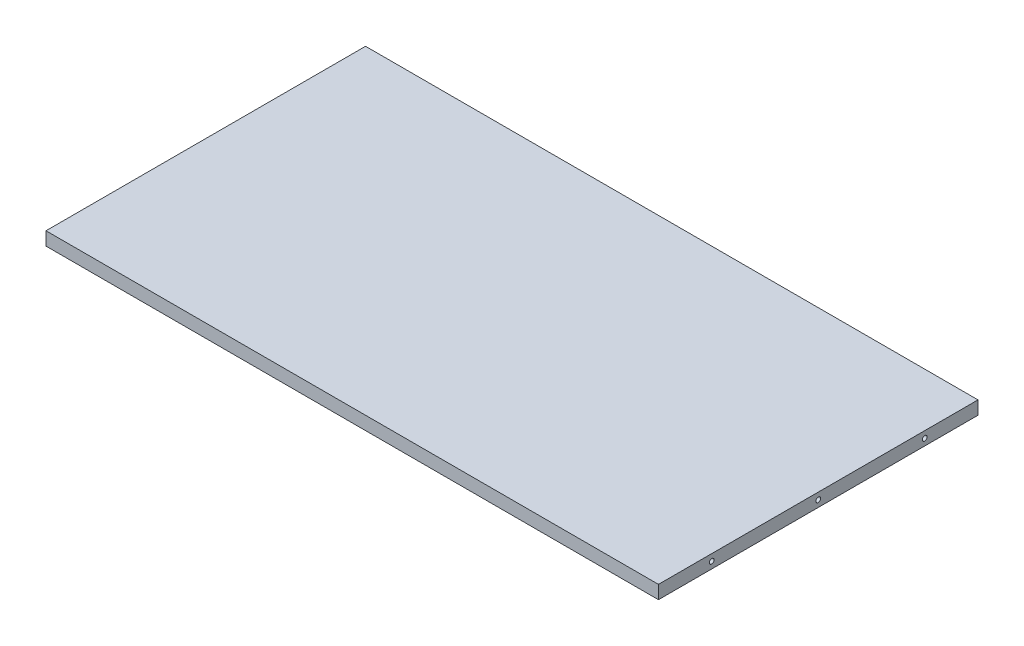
SolidWorks part; units mm, degrees
ref_plane "Front Plane" through (0, 0, 0) normal (0, 0, 1) x (1, 0, 0)
ref_plane "Top Plane" through (0, 0, 0) normal (0, 1, 0) x (1, 0, 0)
ref_plane "Right Plane" through (0, 0, 0) normal (1, 0, 0) x (0, 0, -1)
sketch "Sketch1" plane through (0, 0, 0) normal (0, 1, 0) x (1, 0, 0)
  line L1 (-146.05, -76.2) -> (146.05, -76.2)
  line L2 (-146.05, -76.2) -> (-146.05, 76.2)
  line L3 (-146.05, 76.2) -> (146.05, 76.2)
  line L4 (146.05, -76.2) -> (146.05, 76.2)
  line L5 (-146.05, -76.2) -> (146.05, 76.2) construction
  line L6 (-146.05, 76.2) -> (146.05, -76.2) construction
  point P0 (0, 0)
extrude "Boss-Extrude1" add sketch "Sketch1" along normal blind 6.35
hole_wizard "#4-40 Tapped Hole1" positions "Sketch2" profile "Sketch4" tap size "#4-40" standard "ANSI Inch"
sketch "Sketch2" plane through (146.05, 0, 0) normal (1, 0, 0) x (0, 0, -1)
  line L0 (76.2, 6.35) -> (76.2, 0) construction
  line L1 (-76.2, 0) -> (76.2, 0) construction
  point P0 (0, 3.175)
  point P2 (-50.8, 3.175)
  point P4 (50.8, 3.175)
  point P5 (0, 0)
  dimension "D1" = 76.2
  dimension "D2" = 50.8
  dimension "D3" = 50.8
  dimension "D4" = 3.175
sketch "Sketch4" plane through (146.05, 3.175, 0) normal (0, 1, 0) x (0, 0, -1)
  line L0 (0, 0) -> (0, 8.2992)
  line L1 (0, 8.2992) -> (1.1303, 7.62)
  line L2 (1.1303, 7.62) -> (1.1303, 0)
  line L5 (1.1303, 0) -> (0, 0)
  line L10 (0, 8.2992) -> (-1.1303, 7.62) construction
  line L11 (0, -6.35) -> (0, 107.95) construction
  dimension "Tap Drill Dia." = 2.2606
  dimension "Tap Drill Depth" = 7.62
  dimension "Drill Angle" = 118
hole_wizard "#4-40 Tapped Hole2" positions "Sketch5" profile "Sketch6" tap size "#4-40" standard "ANSI Inch"
sketch "Sketch5" plane through (-146.05, 0, 0) normal (-1, 0, 0) x (0, 0, 1)
  line L0 (76.2, 6.35) -> (76.2, 0) construction
  line L2 (-76.2, 0) -> (76.2, 0) construction
  point P0 (0, 3.175)
  point P2 (50.8, 3.175)
  point P4 (-50.8, 3.175)
  point P13 (0, 2.7751)
  point P16 (0, 0)
  dimension "D1" = 76.2
  dimension "D2" = 50.8
  dimension "D3" = 50.8
  dimension "D4" = 3.175
sketch "Sketch6" plane through (-146.05, 3.175, 0) normal (0, 1, 0) x (0, 0, 1)
  line L0 (0, 0) -> (0, 8.2992)
  line L1 (0, 8.2992) -> (1.1303, 7.62)
  line L2 (1.1303, 7.62) -> (1.1303, 0)
  line L5 (1.1303, 0) -> (0, 0)
  line L10 (0, 8.2992) -> (-1.1303, 7.62) construction
  line L11 (0, -6.35) -> (0, 107.95) construction
  dimension "Tap Drill Dia." = 2.2606
  dimension "Tap Drill Depth" = 7.62
  dimension "Drill Angle" = 118
